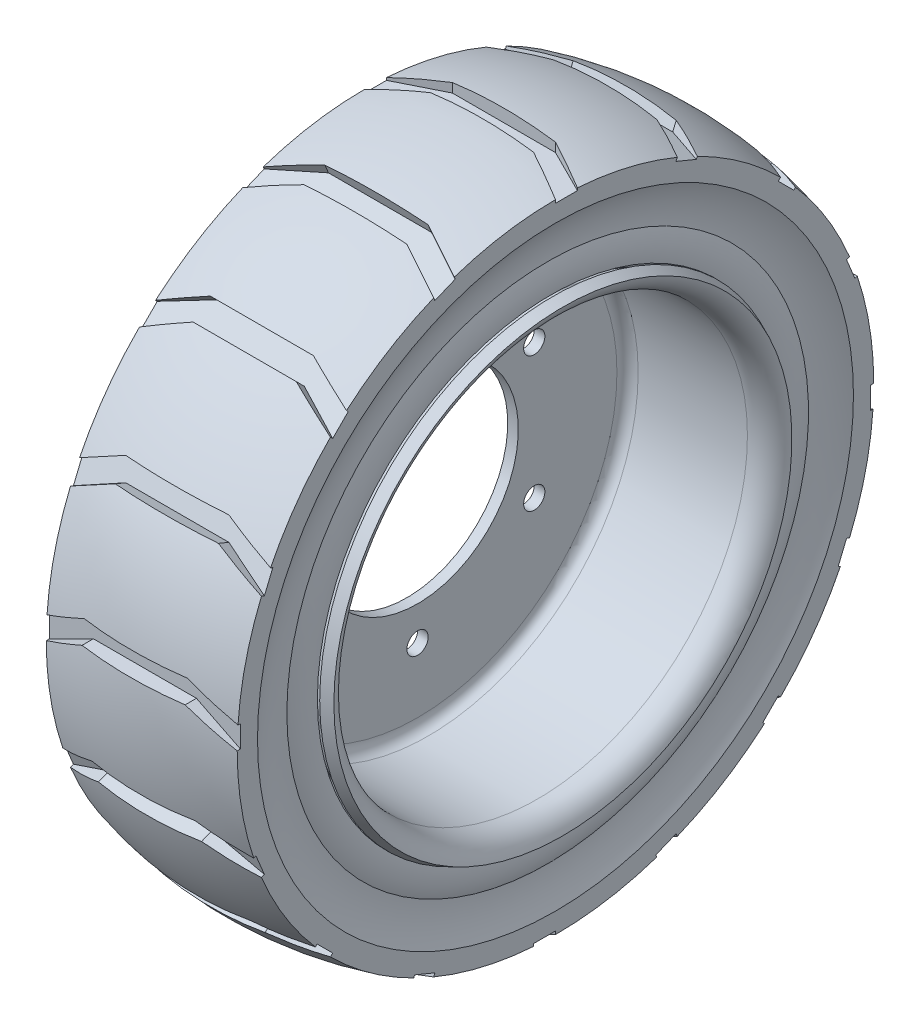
SolidWorks part; units mm, degrees
ref_plane "Front Plane" through (0, 0, 0) normal (0, 0, 1) x (1, 0, 0)
ref_plane "Top Plane" through (0, 0, 0) normal (0, 1, 0) x (1, 0, 0)
ref_plane "Right Plane" through (0, 0, 0) normal (1, 0, 0) x (0, 0, -1)
sketch "Sketch1" plane through (0, 0, 0) normal (0, 0, 1) x (1, 0, 0)
  line L0 (0, 0) -> (180, 0) construction
  line L1 (0, 0) -> (0, 207.3052) construction
  line L2 (180, 0) -> (180, 228.5418) construction
  line L3 (163, 207.9403) -> (44, 207.9403)
  line L4 (40, 187.9403) -> (40, 95)
  line L5 (163, 197.9403) -> (60, 197.9403)
  line L6 (50, 187.9403) -> (50, 95)
  line L7 (50, 95) -> (40, 95)
  line L8 (17, 207.9403) -> (136, 207.9403)
  line L9 (17, 197.9403) -> (30, 197.9403)
  line L10 (2.3016, 219.9476) -> (-6.9796, 215.8708)
  line L11 (-15, 95) -> (-5, 95)
  line L12 (180, 300) -> (180, 280.8817)
  line L13 (175.5792, 220) -> (163.378, 220)
  line L14 (163.378, 220) -> (159.3545, 210.1819)
  line L15 (157.5039, 208.9403) -> (24.5088, 208.9403)
  line L16 (90, 0) -> (90, 88.9382) construction
  line L17 (4.4208, 220) -> (16.622, 220)
  line L18 (16.622, 220) -> (19.8823, 212.0443)
  line L19 (177.6984, 219.9476) -> (186.9796, 215.8708)
  line L20 (0, 300) -> (0, 280.8817)
  line L21 (-5, 162.0036) -> (-5, 187.9403) construction
  line L22 (-15, 162.0036) -> (-15, 187.9403) construction
  line L23 (-5, 162.0036) -> (-5, 95) construction
  line L24 (-15, 162.0036) -> (-15, 95) construction
  line L25 (5, 197.9403) -> (151.9155, 197.9403) construction
  line L26 (151.9155, 197.9403) -> (163, 197.9403) construction
  line L27 (151.9155, 207.9403) -> (163, 207.9403) construction
  line L28 (5, 207.9403) -> (151.9155, 207.9403) construction
  line L29 (60, 197.9403) -> (120, 197.9403)
  arc A0 (0, 300) -> (180, 300) centre (90, -38.2307) cw
  arc A1 (186.9796, 215.8708) -> (163, 197.9403) centre (163, 222.9403) cw
  arc A2 (60, 197.9403) -> (50, 187.9403) centre (60, 187.9403) ccw
  arc A3 (177.6984, 219.9476) -> (163, 207.9403) centre (163, 222.9403) cw
  arc A4 (40, 187.9403) -> (30, 197.9403) centre (30, 187.9403) ccw
  arc A5 (186.9796, 230.0099) -> (163, 197.9403) centre (163, 222.9403) cw construction
  arc A6 (159.3545, 210.1819) -> (157.5039, 208.9403) centre (157.5039, 210.9403) cw
  arc A7 (177.3878, 227.1821) -> (163, 207.9403) centre (163, 222.9403) cw construction
  arc A8 (24.5088, 208.9403) -> (19.8823, 212.0443) centre (24.5088, 213.9403) cw
  arc A9 (-15, 187.9403) -> (5, 207.9403) centre (5, 187.9403) cw construction
  arc A10 (-5, 187.9403) -> (5, 197.9403) centre (5, 187.9403) cw construction
  arc A11 (2.3016, 219.9476) -> (17, 207.9403) centre (17, 222.9403) ccw
  arc A12 (-6.9796, 215.8708) -> (17, 197.9403) centre (17, 222.9403) ccw
  spline S0 degree 2 poles (172.6466, 245.8507) (177.6196, 233.4025) (175.5792, 220) knots 0 0 0 1 1 1
  spline S1 degree 2 poles (0, 280.8817) (7.9714, 264.4477) (7.3534, 245.8507) knots 0 0 0 1 1 1
  spline S2 degree 2 poles (7.3534, 245.8507) (2.3804, 233.4025) (4.4208, 220) knots 0 0 0 1 1 1
  spline S3 degree 2 poles (180, 280.8817) (172.0286, 264.4477) (172.6466, 245.8507) knots 0 0 0 1 1 1
  point P43 (158.8457, 208.9403)
  point P46 (21.1543, 208.9403)
  dimension "D3" = 350
  dimension "D4" = 10
  dimension "D10" = 25
  dimension "D11" = 2
  dimension "D12" = 5
  dimension "D7" = 10
  dimension "D13" = 10
  dimension "D1" = 180
  dimension "D2" = 300
  dimension "D5" = 95
  dimension "D6" = 40
  dimension "D8" = 103
  dimension "D14" = 197.9403
  dimension "D9" = 10
revolve "Revolve1" add sketch "Sketch1" angle 360 about L0
ref_plane "Plane1" through (0, 0, 410) normal (0, 0, 1) x (1, 0, 0)
ref_plane "Plane2" through (-15, 0, 0) normal (-1, 0, 0) x (0, 0, 1)
sketch "Sketch5" plane through (50, 0, 0) normal (1, 0, 0) x (0, 0, -1)
  circle A0 centre (0, 0) radius 127 construction
  circle A1 centre (0, 127) radius 10
  dimension "D1" = 254
  dimension "D2" = 20
extrude "Cut-Extrude1" cut sketch "Sketch5" against normal through all
pattern_circular "CirPattern1" count 6 over 360 about axis through (0, 0, 0) along (1, 0, 0) of "Cut-Extrude1"
ref_plane "Plane3" through (0, 0, 315) normal (0, 0, 1) x (1, 0, 0)
sketch "Sketch8" plane through (0, 0, 315) normal (0, 0, 1) x (1, 0, 0)
  line L0 (41.4175, 41.4175) -> (0, 20.7088)
  line L1 (41.4175, 41.4175) -> (138.5825, 41.4175)
  line L2 (0, 300) -> (0, -300) construction
  line L3 (180, -300) -> (180, 300) construction
  line L4 (180, 0) -> (138.5825, 20.7088)
  line L5 (138.5825, 20.7088) -> (41.4175, 20.7088)
  line L6 (41.4175, 20.7088) -> (0, 0)
  line L7 (0, 20.7088) -> (0, 0)
  line L8 (180, 0) -> (180, 20.7088)
  line L10 (180, 20.7088) -> (138.5825, 41.4175)
extrude "Cut-Extrude16" cut sketch "Sketch8" against normal blind 18
pattern_circular "CirPattern2" count 16 over 360 about axis through (0, 0, 0) along (1, 0, 0) of "Cut-Extrude16"
